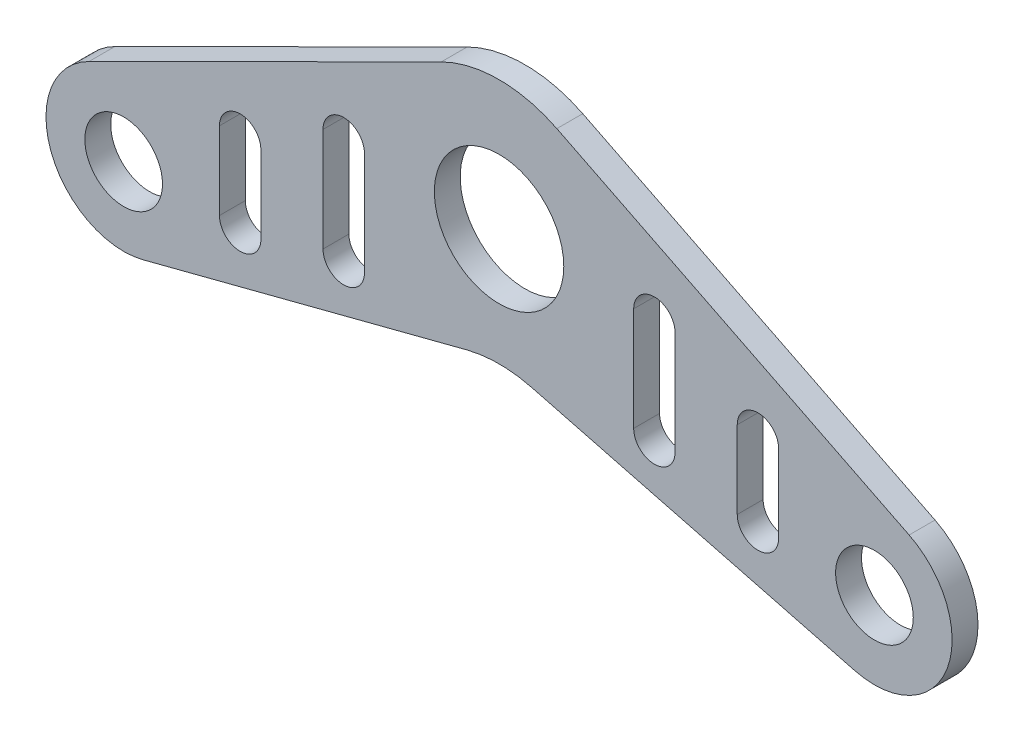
SolidWorks part; units mm, degrees
ref_plane "Front Plane" through (0, 0, 0) normal (0, 0, 1) x (1, 0, 0)
ref_plane "Top Plane" through (0, 0, 0) normal (0, 1, 0) x (1, 0, 0)
ref_plane "Right Plane" through (0, 0, 0) normal (1, 0, 0) x (0, 0, -1)
sketch "Sketch1" plane through (0, 0, 0) normal (0, 0, 1) x (1, 0, 0)
  line L0 (-158.3944, -23.1562) -> (-22.324, 44.7397)
  line L1 (22.324, 44.7397) -> (158.3944, -23.1562)
  line L2 (0, 0) -> (0, -91.1984) construction
  line L3 (-137.4794, -79.0421) -> (-12.5343, -46.6869)
  line L4 (12.5343, -46.6869) -> (137.4794, -79.0421)
  arc A0 (-158.3944, -23.1562) -> (-137.4794, -79.0421) centre (-145, -50) ccw
  circle A1 centre (0, 0) radius 25
  arc A2 (22.324, 44.7397) -> (-22.324, 44.7397) centre (0, 0) ccw
  arc A3 (137.4794, -79.0421) -> (158.3944, -23.1562) centre (145, -50) ccw
  arc A4 (-12.5343, -46.6869) -> (12.5343, -46.6869) centre (0, -95.0904) cw
  circle A5 centre (-145, -50) radius 15
  circle A6 centre (145, -50) radius 15
  dimension "D1" = 50
  dimension "D2" = 30
  dimension "D3" = 50
  dimension "D4" = 50
  dimension "D7" = 30
  dimension "D5" = 145
  dimension "D6" = 12
extrude "Boss-Extrude1" add sketch "Sketch1" along normal blind 10
sketch "Sketch2" plane through (0, 0, 10) normal (0, 0, 1) x (1, 0, 0)
  line L0 (-60, -0.6897) -> (-60, -40.6897) construction
  line L1 (-52, -0.6897) -> (-52, -40.6897)
  line L2 (-68, -0.6897) -> (-68, -40.6897)
  line L3 (-100, -19.4828) -> (-100, -49.4828) construction
  line L4 (-92, -19.4828) -> (-92, -49.4828)
  line L5 (-108, -19.4828) -> (-108, -49.4828)
  line L9 (-145, -50) -> (0, 0) construction
  arc A0 (-52, -0.6897) -> (-68, -0.6897) centre (-60, -0.6897) ccw
  arc A1 (-68, -40.6897) -> (-52, -40.6897) centre (-60, -40.6897) ccw
  arc A2 (-92, -19.4828) -> (-108, -19.4828) centre (-100, -19.4828) ccw
  arc A3 (-108, -49.4828) -> (-92, -49.4828) centre (-100, -49.4828) ccw
  point P2 (-60, -20.6897)
  point P7 (-100, -34.4828)
  dimension "D1" = 40
  dimension "D3" = 8
  dimension "D5" = 8
  dimension "D2" = 60
  dimension "D4" = 30
  dimension "D6" = 40
extrude "Cut-Extrude1" cut sketch "Sketch2" against normal up to next
mirror "Mirror1" about plane through (0, 0, 0) normal (1, 0, 0) of "Cut-Extrude1"
